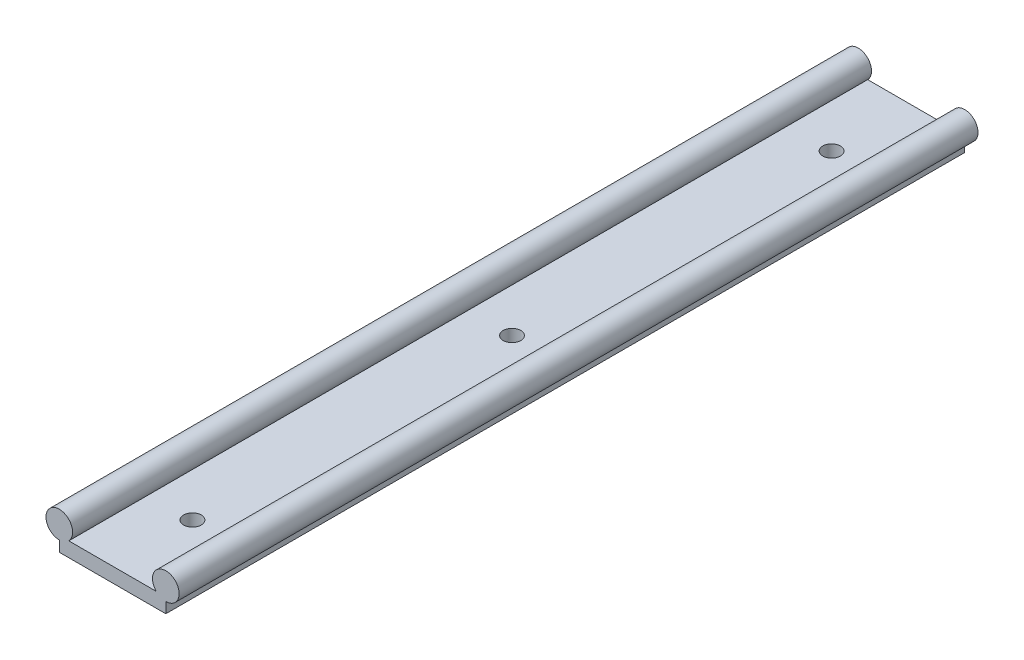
SolidWorks part; units mm, degrees
ref_plane "Alzado" through (0, 0, 0) normal (0, 0, 1) x (1, 0, 0)
ref_plane "Planta" through (0, 0, 0) normal (0, 1, 0) x (1, 0, 0)
ref_plane "Vista lateral" through (0, 0, 0) normal (1, 0, 0) x (0, 0, -1)
sketch "Croquis1" plane through (0, 0, 0) normal (0, 0, 1) x (1, 0, 0)
  line L0 (0, 2.75) -> (0, -2.75) construction
  line L1 (16.4293, 2.75) -> (-16.4293, 2.75)
  line L2 (20, 1.25) -> (20, -2.75)
  line L3 (20, -2.75) -> (-20, -2.75)
  line L4 (-20, 1.25) -> (-20, -2.75)
  arc A0 (-20, 1.25) -> (-16.4293, 2.75) centre (-20, 6.25) cw
  arc A1 (20, 1.25) -> (16.4293, 2.75) centre (20, 6.25) ccw
extrude "Extruir1" add sketch "Croquis1" along normal blind 300
sketch "Croquis7" plane through (0, 2.75, 0) normal (0, 1, 0) x (1, 0, 0)
  point P0 (0, -270)
  point P1 (0, -150)
  point P2 (0, -30)
hole_wizard "Taladro de diámetro de Ø6.6 (6.6)1" positions "Croquis3D1" profile "Croquis8" hole size "Ø6.6" standard "DIN"
sketch3d "Croquis3D1"
  point P0 (0, 2.75, 270)
  point P3 (0, 2.75, 150)
  point P6 (0, 2.75, 30)
sketch "Croquis8" plane through (0, 2.75, 270) normal (1, 0, 0) x (0, 0, 1)
  line L0 (0, 0) -> (0, 5.5)
  line L1 (0, 5.5) -> (3.3, 5.5)
  line L2 (3.3, 5.5) -> (3.3, 0)
  line L5 (3.3, 0) -> (0, 0)
  line L11 (0, -6.35) -> (0, 107.95) construction
  dimension "Diámetro de taladro hasta el siguiente" = 6.6
  dimension "Profundidad de taladro hasta el siguiente" = 5.5
